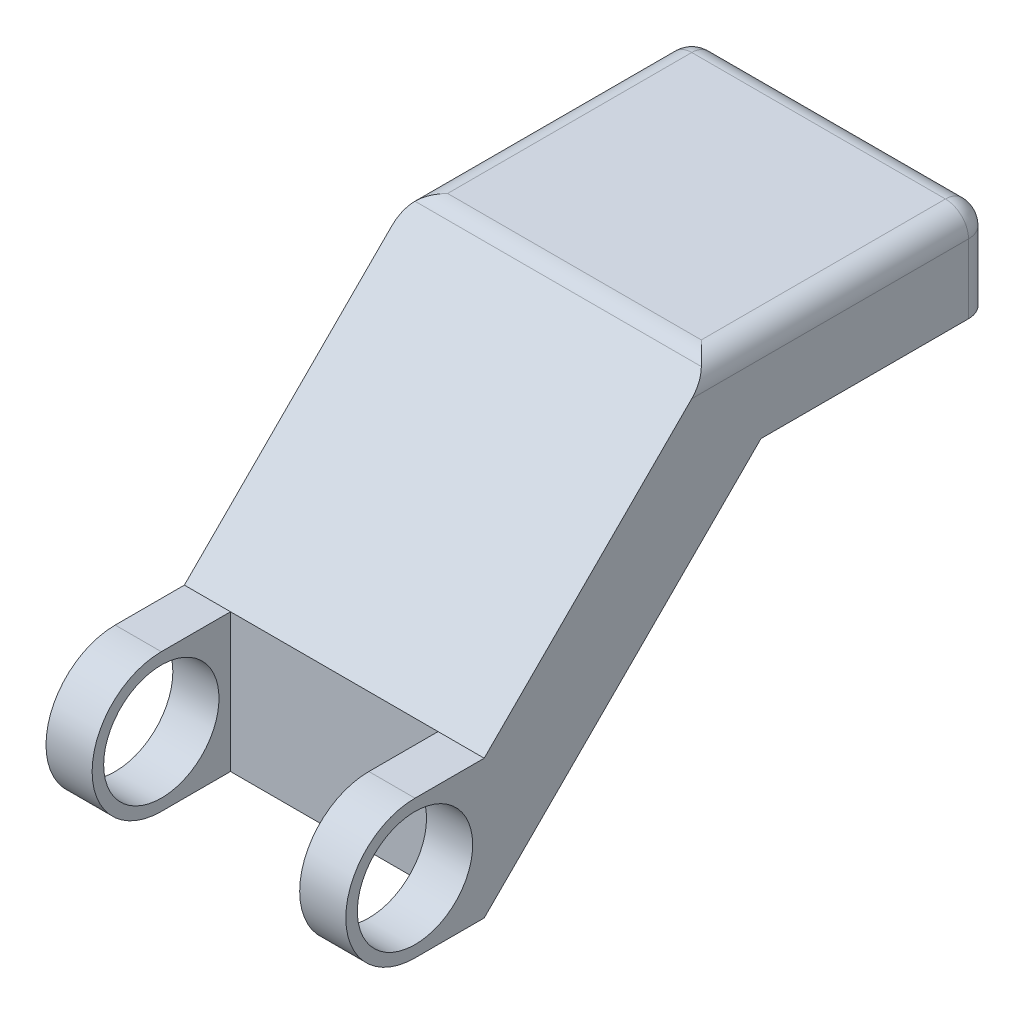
SolidWorks part; units mm, degrees
ref_plane "Front Plane" through (0, 0, 0) normal (0, 0, 1) x (1, 0, 0)
ref_plane "Top Plane" through (0, 0, 0) normal (0, 1, 0) x (1, 0, 0)
ref_plane "Right Plane" through (0, 0, 0) normal (1, 0, 0) x (0, 0, -1)
sketch "Sketch1" plane through (0, 0, 0) normal (1, 0, 0) x (0, 0, -1)
  line L0 (0, 0) -> (-15, 0)
  line L1 (-15, 30) -> (0, 30)
  line L3 (0, 30) -> (50, 80)
  line L4 (50, 80) -> (110, 80)
  line L5 (110, 80) -> (110, 60)
  line L6 (110, 60) -> (60, 60)
  line L7 (60, 60) -> (0, 0)
  arc A0 (-15, 30) -> (-15, 0) centre (-15, 15) ccw
  circle A1 centre (-15, 15) radius 12.5
  dimension "D1" = 25
  dimension "D2" = 30
  dimension "D3" = 15
  dimension "D4" = 15
  dimension "D5" = 135
  dimension "D6" = 135
  dimension "D7" = 60
  dimension "D8" = 80
  dimension "D9" = 20
extrude "Boss-Extrude1" add sketch "Sketch1" along normal blind 65
sketch "Sketch2" plane through (0, 30, 0) normal (0, 1, 0) x (1, 0, 0)
  line L0 (65, 0) -> (0, 0) construction
  line L1 (10, 0) -> (55, 0)
  line L2 (10, 0) -> (10, -30)
  line L3 (10, -30) -> (55, -30)
  line L4 (55, 0) -> (55, -30)
  line L5 (0, -30) -> (65, -30) construction
  line L6 (0, 0) -> (0, -15) construction
  line L7 (65, 0) -> (65, -15) construction
  dimension "D1" = 10
  dimension "D2" = 10
extrude "Cut-Extrude1" cut sketch "Sketch2" against normal through all both and the other way through all
fillet "Fillet1" radius 5 6 edges at (32.5, 80, -50) (65, 80, -80) (0, 80, -80) (32.5, 80, -110) (65, 70, -110) (0, 70, -110)
